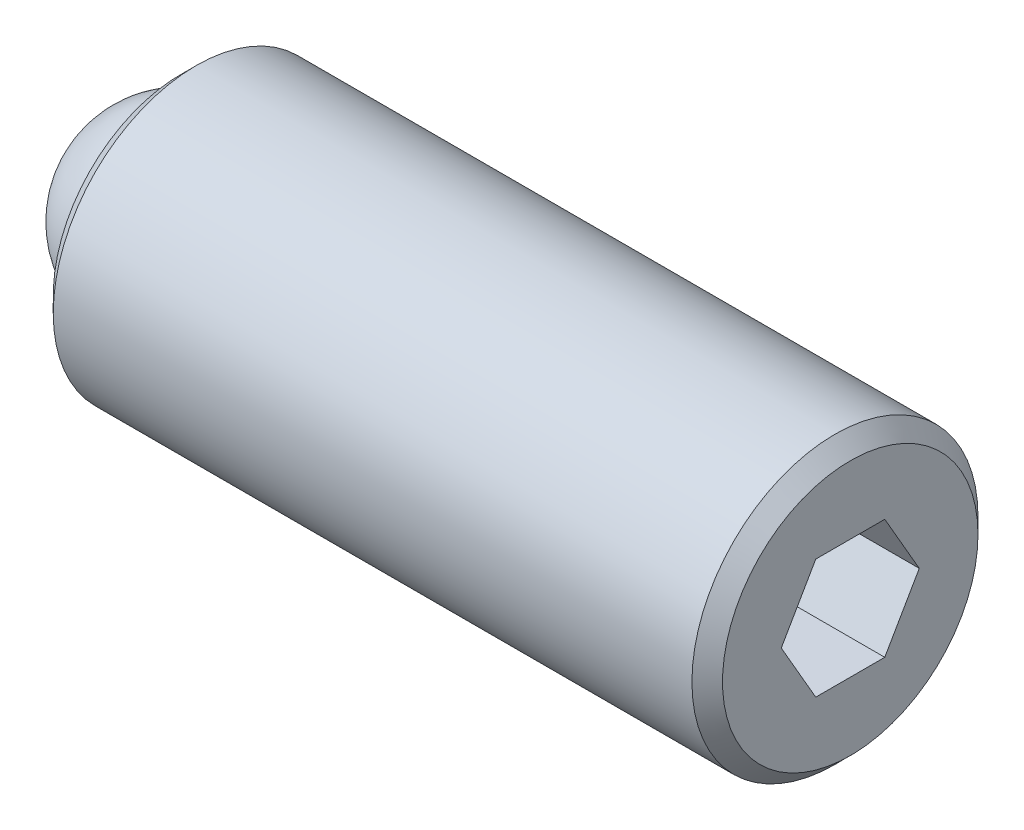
SolidWorks part; units mm, degrees
ref_plane "Front Plane" through (0, 0, 0) normal (0, 0, 1) x (1, 0, 0)
ref_plane "Top Plane" through (0, 0, 0) normal (0, 1, 0) x (1, 0, 0)
ref_plane "Right Plane" through (0, 0, 0) normal (1, 0, 0) x (0, 0, -1)
sketch "Sketch2" plane through (0, 0, 0) normal (1, 0, 0) x (0, 0, -1)
  circle A0 centre (0, 0) radius 2.3749
  dimension "D1" = 4.7498
extrude "Boss-Extrude1" add sketch "Sketch2" along normal blind 11.1125
sketch "Sketch3" plane through (0, 0, 0) normal (-1, 0, 0) x (0, 0, 1)
  circle A0 centre (0, 0) radius 1.5875
  dimension "D1" = 3.175
chamfer "Chamfer1" distance 0.254 angle 45 1 edges at (0, 0, -2.3749)
chamfer "Chamfer2" distance 0.254 angle 45 1 edges at (11.1125, 0, -2.3749)
sketch "Sketch4" plane through (11.1125, 0, 0) normal (1, 0, 0) x (0, 0, -1)
  line L1 (1.1457, 0) -> (0.5728, 0.9922)
  line L2 (0.5728, 0.9922) -> (-0.5728, 0.9922)
  line L3 (-0.5728, 0.9922) -> (-1.1457, 0)
  line L4 (-1.1457, 0) -> (-0.5728, -0.9922)
  line L5 (-0.5728, -0.9922) -> (0.5728, -0.9922)
  line L6 (0.5728, -0.9922) -> (1.1457, 0)
  circle A0 centre (0, 0) radius 0.9922 construction
extrude "Cut-Extrude2" cut sketch "Sketch4" against normal blind 2.286
extrude "Cut-Extrude3" cut sketch "Sketch3" against normal blind 1.5875
sketch "Sketch5" plane through (0, 0, 0) normal (-1, 0, 0) x (0, 0, 1)
  line L0 (0, 0) -> (0, -1.5875)
  line L1 (0, 0) -> (0, 1.5875)
  arc A0 (0, 1.5875) -> (0, -1.5875) centre (0, 0) ccw
revolve "Revolve1" add sketch "Sketch5" angle 360 about L1
sketch "Sketch6" plane through (0, 0, 0) normal (-1, 0, 0) x (0, 0, 1)
  line L0 (0, 0) -> (0, 1.5875) construction
  arc A0 (0.0635, 1.5862) -> (-0.0635, 1.5862) centre (0, 0) ccw
  circle A1 centre (0, 0) radius 1.5875 construction
  circle A3 centre (0, 0) radius 1.5875 construction
  arc A4 (0.0635, 1.5862) -> (-0.0635, 1.5862) centre (0, 1.5875) ccw
  dimension "D1" = 0.127
extrude "Cut-Extrude6" cut sketch "Sketch6" against normal blind 1.5875
